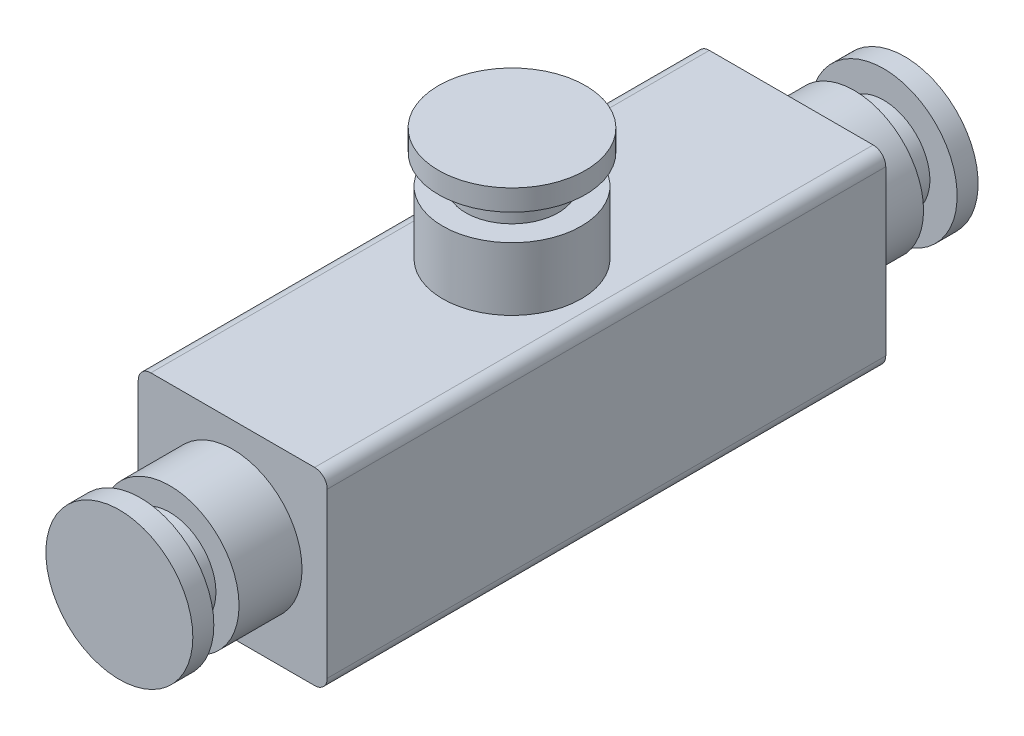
SolidWorks part; units mm, degrees
ref_plane "前视基准面" through (0, 0, 0) normal (0, 0, 1) x (1, 0, 0)
ref_plane "上视基准面" through (0, 0, 0) normal (0, 1, 0) x (1, 0, 0)
ref_plane "右视基准面" through (0, 0, 0) normal (1, 0, 0) x (0, 0, -1)
sketch "草图1" plane through (0, 0, 0) normal (0, 0, 1) x (1, 0, 0)
  line L1 (19.5, 22.5) -> (-19.5, 22.5)
  line L2 (22.5, 19.5) -> (22.5, -19.5)
  line L3 (19.5, -22.5) -> (-19.5, -22.5)
  line L4 (-22.5, 19.5) -> (-22.5, -19.5)
  line L5 (22.5, 22.5) -> (-22.5, -22.5) construction
  line L6 (22.5, -22.5) -> (-22.5, 22.5) construction
  arc A0 (-22.5, -19.5) -> (-19.5, -22.5) centre (-19.5, -19.5) ccw
  arc A1 (22.5, -19.5) -> (19.5, -22.5) centre (19.5, -19.5) cw
  arc A2 (19.5, 22.5) -> (22.5, 19.5) centre (19.5, 19.5) cw
  arc A3 (-22.5, 19.5) -> (-19.5, 22.5) centre (-19.5, 19.5) cw
  point P0 (0, 0)
  dimension "D3" = 3
  dimension "D1" = 45
  dimension "D2" = 45
extrude "凸台-拉伸2" add sketch "草图1" along normal blind 133
sketch "草图2" plane through (0, 22.5, 0) normal (0, 1, 0) x (1, 0, 0)
  line L0 (0, 0) -> (0, -133) construction
  line L1 (19.5, 0) -> (-19.5, 0) construction
  circle A0 centre (0, -66.5) radius 16.5
extrude "凸台-拉伸3" add sketch "草图2" along normal blind 15
sketch "草图3" plane through (0, 0, 133) normal (0, 0, 1) x (1, 0, 0)
  circle A0 centre (0, 0) radius 16.5
extrude "凸台-拉伸4" add sketch "草图3" along normal blind 15
sketch "草图4" plane through (0, 0, 0) normal (0, 0, -1) x (-1, 0, 0)
  circle A0 centre (0, 0) radius 16.5
extrude "凸台-拉伸5" add sketch "草图4" along normal blind 15
sketch "草图5" plane through (0, 37.5, 0) normal (0, 1, 0) x (1, 0, 0)
  circle A0 centre (0, -66.5) radius 11
extrude "凸台-拉伸6" add sketch "草图5" along normal blind 7
sketch "草图6" plane through (0, 0, 148) normal (0, 0, 1) x (1, 0, 0)
  circle A0 centre (0, 0) radius 11
extrude "凸台-拉伸7" add sketch "草图6" along normal blind 7
sketch "草图7" plane through (0, 0, -15) normal (0, 0, -1) x (-1, 0, 0)
  circle A0 centre (0, 0) radius 11
extrude "凸台-拉伸8" add sketch "草图7" along normal blind 7
sketch "草图8" plane through (0, 44.5, 0) normal (0, 1, 0) x (1, 0, 0)
  circle A0 centre (0, -66.5) radius 17.5
extrude "凸台-拉伸9" add sketch "草图8" along normal blind 5
sketch "草图9" plane through (0, 0, -22) normal (0, 0, -1) x (-1, 0, 0)
  circle A0 centre (0, 0) radius 17.5
extrude "凸台-拉伸10" add sketch "草图9" along normal blind 5
sketch "草图10" plane through (0, 0, 155) normal (0, 0, 1) x (1, 0, 0)
  circle A0 centre (0, 0) radius 17.5
extrude "凸台-拉伸11" add sketch "草图10" along normal blind 5
sketch "草图11" plane through (0, -22.5, 0) normal (0, -1, 0) x (1, 0, 0)
  line L0 (0, 0) -> (0, 34.5) construction
  line L1 (-19.5, 0) -> (19.5, 0) construction
  circle A0 centre (0, 34.5) radius 10
extrude "切除-拉伸1" cut sketch "草图11" against normal blind 5
